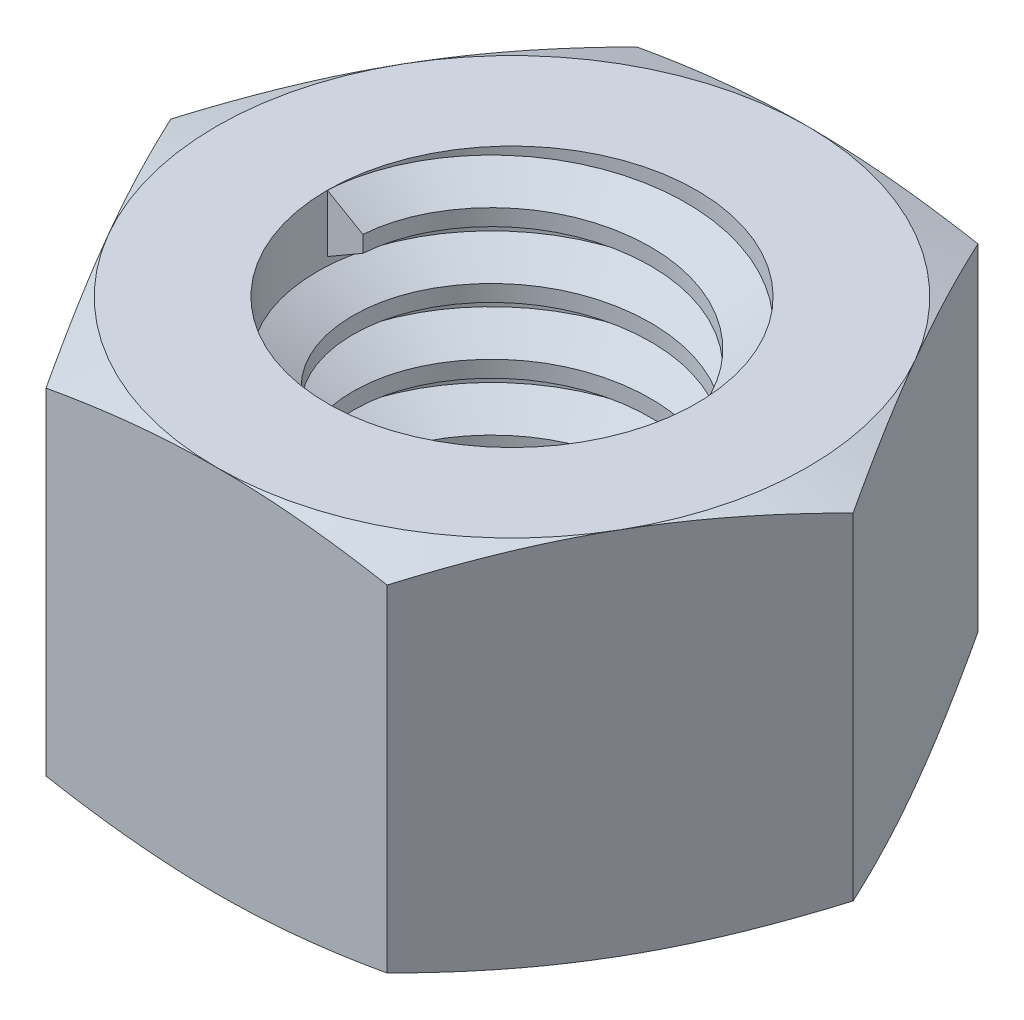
SolidWorks part; units mm, degrees
ref_plane "Front Plane" through (0, 0, 0) normal (0, 0, 1) x (1, 0, 0)
ref_plane "Top Plane" through (0, 0, 0) normal (0, 1, 0) x (1, 0, 0)
ref_plane "Right Plane" through (0, 0, 0) normal (1, 0, 0) x (0, 0, -1)
sketch "Sketch1" plane through (0, 0, 0) normal (0, 1, 0) x (1, 0, 0)
  line L1 (7.3323, 0) -> (3.6662, 6.35)
  line L2 (3.6662, 6.35) -> (-3.6662, 6.35)
  line L3 (-3.6662, 6.35) -> (-7.3323, 0)
  line L4 (-7.3323, 0) -> (-3.6662, -6.35)
  line L5 (-3.6662, -6.35) -> (3.6662, -6.35)
  line L6 (3.6662, -6.35) -> (7.3323, 0)
  circle A0 centre (0, 0) radius 6.35 construction
  circle A1 centre (0, 0) radius 3.9688
  dimension "D1" = 7.9375
  dimension "D2" = 12.7
extrude "Boss-Extrude1" add sketch "Sketch1" along normal blind 7.9375
thread "Thread1" pitch 1.4111 start angle 0, offset 0, length 6.858, pitch 1.4111, diameter 7.9375
ref_plane "Plane1" through (-3.9688, 7.9375, 0) normal (0, 0, 1) x (-1, 0, 0)
sketch "Thread Profile1" plane through (-3.9688, 7.9375, 0) normal (0, 0, 1) x (-1, 0, 0)
  line L0 (0, 0) -> (0, 1.4111) construction
  line L11 (0, 0) -> (0, 1.2347)
  line L12 (0, 1.2347) -> (-0.7638, 0.7937)
  line L13 (-0.7638, 0.7937) -> (-0.7638, 0.441)
  line L15 (-0.7638, 0.441) -> (0, 0)
  line L17 (-0.7638, 0.6174) -> (0, 0.6174) construction
  point P2 (0, 0)
  dimension "Pitch" = 1.4111
  dimension "Profile_Angle" = 60
  dimension "Profile_Land" = 0.3528
  dimension "Profile_Height" = 0.7638
sketch "Sketch4" plane through (0, 0, 0) normal (1, 0, 0) x (0, 0, -1)
  line L0 (-6.35, 7.9375) -> (-12.3602, 7.9375)
  line L1 (-12.3602, 7.9375) -> (-12.3602, 5.75)
  line L2 (-12.3602, 5.75) -> (-6.35, 7.9375)
  line L3 (-6.35, 0) -> (-12.2981, 0)
  line L4 (-12.2981, 0) -> (-12.2981, 2.1649)
  line L5 (-12.2981, 2.1649) -> (-6.35, 0)
  line L6 (0, 7.9375) -> (0, 9.2992) construction
  dimension "D1" = 20
  dimension "D2" = 20
revolve "Cut-Revolve1" cut sketch "Sketch4" angle 360 about L6
